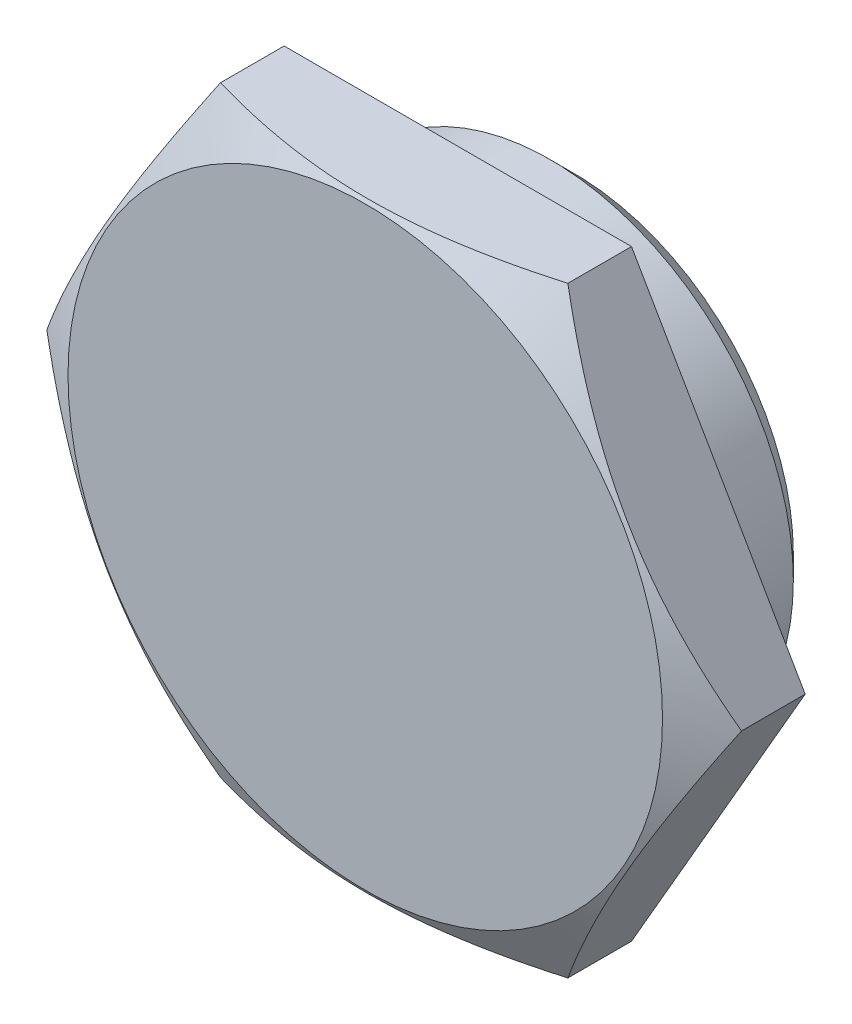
SolidWorks part; units mm, degrees
ref_plane "Plan1" through (0, 0, 0) normal (0, 0, 1) x (1, 0, 0)
ref_plane "Plan2" through (0, 0, 0) normal (0, 1, 0) x (1, 0, 0)
ref_plane "Plan3" through (0, 0, 0) normal (1, 0, 0) x (0, 0, -1)
sketch "Esquisse1" plane through (0, 0, 0) normal (0, 0, 1) x (1, 0, 0)
  line L1 (-30.0222, 0) -> (-15.0111, -26)
  line L2 (-15.0111, -26) -> (15.0111, -26)
  line L3 (15.0111, -26) -> (30.0222, 0)
  line L4 (30.0222, 0) -> (15.0111, 26)
  line L5 (15.0111, 26) -> (-15.0111, 26)
  line L6 (-15.0111, 26) -> (-30.0222, 0)
  circle A0 centre (0, 0) radius 26 construction
  dimension "D1" = 52
extrude "Base-Extrusion" add sketch "Esquisse1" along normal blind 8
sketch "Esquisse3" plane through (0, 0, 0) normal (0, 1, 0) x (1, 0, 0)
  line L0 (-30.0222, -5.5) -> (-25.6921, -8)
  line L1 (-30.0222, -5.5) -> (-30.0222, -8)
  line L2 (-30.0222, -8) -> (-25.6921, -8)
  line L4 (0, 0) -> (0, -12.2) construction
  dimension "D1" = 60
  dimension "D2" = 2.5
revolve "Enlèvement de matière-Révolution1" cut sketch "Esquisse3" angle 360 about L4
sketch "Esquisse4" plane through (0, 0, 0) normal (1, 0, 0) x (0, 0, -1)
  line L0 (0, 19) -> (2, 19)
  line L1 (0, 0) -> (0, 26) construction
  line L2 (2, 19) -> (2, 21)
  line L3 (2, 21) -> (8, 21)
  line L4 (8, 21) -> (10, 19)
  line L5 (10, 19) -> (10, 12)
  line L6 (10, 12) -> (2, 12)
  line L7 (2, 12) -> (2, 0)
  line L8 (0, 19) -> (0, 0)
  line L9 (0, 0) -> (13.6, 0) construction
  line L10 (2, 0) -> (0, 0)
  dimension "D1" = 45
  dimension "D2" = 2
  dimension "D3" = 24
  dimension "D4" = 42
  dimension "D5" = 2
  dimension "D6" = 10
  dimension "D7" = 38
  dimension "D8" = 8
revolve "Boss.-Révol.1" add sketch "Esquisse4" angle 360 about L9
